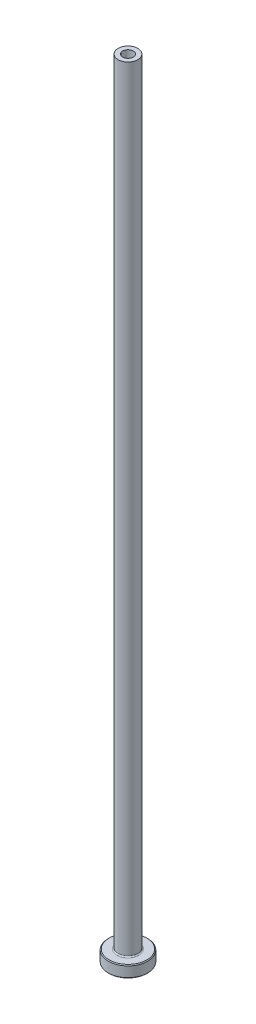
SolidWorks part; units mm, degrees
ref_plane "Front Plane" through (0, 0, 0) normal (0, 0, 1) x (1, 0, 0)
ref_plane "Top Plane" through (0, 0, 0) normal (0, 1, 0) x (1, 0, 0)
ref_plane "Right Plane" through (0, 0, 0) normal (1, 0, 0) x (0, 0, -1)
sketch "Sketch1" plane through (0, 0, 0) normal (0, 0, 1) x (1, 0, 0)
  line L0 (-1.35, 200) -> (-2.5, 200)
  line L1 (-2.5, 200) -> (-2.5, 3)
  line L2 (-2.5, 3) -> (-5, 3)
  line L3 (-5, 3) -> (-5, 0)
  line L4 (5.5, 0) -> (-5.5, 0) construction
  line L5 (-5, 0) -> (-1.6, 0)
  line L6 (-1.35, 155) -> (-1.35, 200)
  line L7 (0, 92.1877) -> (0, -15.5353) construction
  line L8 (0, -5.5) -> (0, 5.5) construction
  line L9 (-1.35, 155) -> (-1.6, 143)
  line L10 (-1.6, 143) -> (-1.6, 0)
  dimension "D1" = 0.25
  dimension "ID" = 2.7
  dimension "OD" = 5
  dimension "L" = 200
  dimension "H" = 10
  dimension "T" = 3
  dimension "N" = 45
  dimension "D2" = 12
revolve "Revolve1" add sketch "Sketch1" angle 360 about L7
fillet "Fillet1" radius 0.3 1 edges at (0, 3, 2.5)
chamfer "Chamfer1" distance 0.2 angle 45 2 edges at (0, 3, 5) (0, 0, 5)
chamfer "Chamfer3" distance 0.5 angle 45 1 edges at (0, 0, 1.6)
